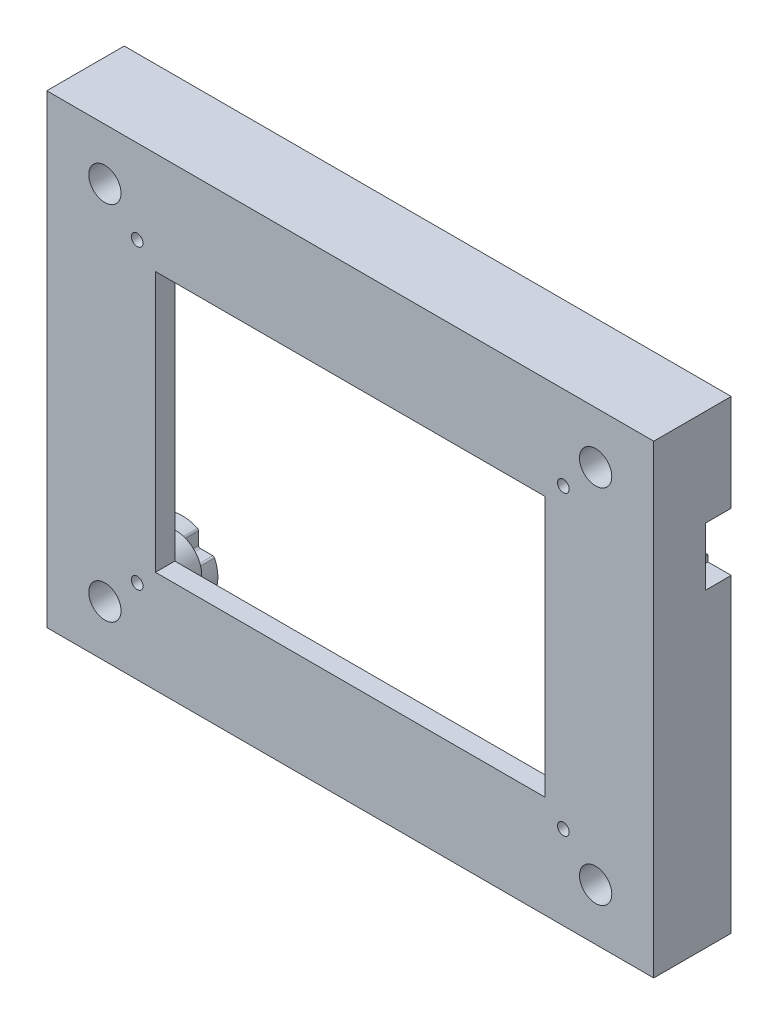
SolidWorks part; units mm, degrees
ref_plane "Front Plane" through (0, 0, 0) normal (0, 0, 1) x (1, 0, 0)
ref_plane "Top Plane" through (0, 0, 0) normal (0, 1, 0) x (1, 0, 0)
ref_plane "Right Plane" through (0, 0, 0) normal (1, 0, 0) x (0, 0, -1)
sketch "草图1" plane through (0, 0, 0) normal (0, 0, 1) x (1, 0, 0)
  line L0 (-34.2251, 32) -> (34.2251, 32)
  line L1 (-47, 36) -> (47, 36)
  line L2 (-47, 36) -> (-47, -36)
  line L3 (-47, -36) -> (47, -36)
  line L4 (47, 36) -> (47, -36)
  line L5 (-47, 36) -> (47, -36) construction
  line L6 (-47, -36) -> (47, 36) construction
  line L8 (-41.7778, 32) -> (-41.7778, 31.9973)
  line L10 (41.7778, 32) -> (41.7778, 31.9973)
  line L11 (-41.7778, 32) -> (41.7778, -32) construction
  line L12 (-41.7778, -32) -> (41.7778, 32) construction
  line L13 (-41.7778, 24.0027) -> (-41.7778, -24.0027)
  line L14 (-41.7778, -31.9973) -> (-41.7778, -32)
  line L15 (-34.2251, -32) -> (34.2251, -32)
  line L16 (41.7749, 32) -> (41.7778, 32)
  line L17 (41.7778, 24.0027) -> (41.7778, -24.0027)
  line L18 (41.7778, -31.9973) -> (41.7778, -32)
  line L19 (41.7749, -32) -> (41.7778, -32)
  circle A0 centre (-38, 28) radius 1.65
  circle A1 centre (-38, -28) radius 1.65
  circle A2 centre (38, 28) radius 1.65
  circle A3 centre (38, -28) radius 1.65
  arc A4 (-41.7778, 24.0027) -> (-34.2251, 32) centre (-38, 28) ccw
  arc A5 (-41.7778, -31.9973) -> (-41.7749, -32) centre (-38, -28) ccw
  arc A6 (34.2251, 32) -> (41.7778, 24.0027) centre (38, 28) ccw
  arc A7 (41.7778, -24.0027) -> (34.2251, -32) centre (38, -28) ccw
  arc A8 (-41.7749, 32) -> (-41.7778, 31.9973) centre (-38, 28) ccw
  arc A9 (-34.2251, -32) -> (-41.7778, -24.0027) centre (-38, -28) ccw
  arc A10 (41.7778, 31.9973) -> (41.7749, 32) centre (38, 28) ccw
  arc A11 (41.7749, -32) -> (41.7778, -31.9973) centre (38, -28) ccw
  point P0 (0, 0)
  point P19 (0, 0)
  point P40 (0, 0)
  dimension "D1" = 3.3
  dimension "D2" = 11
extrude "凸台-拉伸1" add sketch "草图1" along normal blind 12
sketch "草图2" plane through (0, 0, 12) normal (0, 0, 1) x (1, 0, 0)
  circle A0 centre (-38, -28) radius 2.5
  circle A1 centre (-38, 28) radius 2.5
  circle A2 centre (38, 28) radius 2.5
  circle A3 centre (38, -28) radius 2.5
  dimension "D1" = 5
extrude "切除-拉伸1" cut sketch "草图2" against normal blind 7.5
sketch "草图3" plane through (0, 0, 12) normal (0, 0, 1) x (1, 0, 0)
  line L1 (33, -23) -> (-33, -23) construction
  line L2 (33, -23) -> (33, 23) construction
  line L3 (33, 23) -> (-33, 23) construction
  line L4 (-33, -23) -> (-33, 23) construction
  line L5 (33, -23) -> (-33, 23) construction
  line L6 (33, 23) -> (-33, -23) construction
  circle A0 centre (33, -23) radius 4
  circle A1 centre (-33, -23) radius 4
  circle A2 centre (-33, 23) radius 4
  circle A3 centre (33, 23) radius 4
  point P0 (0, 0)
  dimension "D3" = 8
  dimension "D1" = 46
  dimension "D2" = 66
extrude "凸台-拉伸2" add sketch "草图3" against normal blind 6
sketch "草图4" plane through (0, 0, 0) normal (0, 0, -1) x (-1, 0, 0)
  line L1 (-35.5, 25.5) -> (35.5, 25.5)
  line L2 (-35.5, 25.5) -> (-35.5, -25.5)
  line L3 (-35.5, -25.5) -> (35.5, -25.5)
  line L4 (35.5, 25.5) -> (35.5, -25.5)
  line L5 (-35.5, 25.5) -> (35.5, -25.5) construction
  line L6 (-35.5, -25.5) -> (35.5, 25.5) construction
  point P0 (0, 0)
  dimension "D1" = 51
  dimension "D2" = 71
extrude "切除-拉伸2" cut sketch "草图4" against normal up to surface (6 mm away)
fillet "圆角1" radius 0.3 12 edges at (33.101, -25.5, 3) (35.5, -25.5, 3) (35.5, -23.101, 3) (35.5, 23.101, 3) (35.5, 25.5, 3) (33.101, 25.5, 3) (-33.101, 25.5, 3) (-35.5, 23.101, 3) (-35.5, 25.5, 3) (-35.5, -25.5, 3) (-33.101, -25.5, 3) (-35.5, -23.101, 3)
sketch "草图5" plane through (0, 0, 12) normal (0, 0, 1) x (1, 0, 0)
  line L1 (30.1716, -20.1716) -> (-30.1716, -20.1716)
  line L2 (30.1716, -20.1716) -> (30.1716, 20.1716)
  line L3 (30.1716, 20.1716) -> (-30.1716, 20.1716)
  line L4 (-30.1716, -20.1716) -> (-30.1716, 20.1716)
  line L5 (30.1716, -20.1716) -> (-30.1716, 20.1716) construction
  line L6 (30.1716, 20.1716) -> (-30.1716, -20.1716) construction
  line L7 (41.7778, -32) -> (-41.7778, -32)
  line L8 (41.7778, -32) -> (41.7778, 32)
  line L9 (41.7778, 32) -> (-41.7778, 32)
  line L10 (-41.7778, -32) -> (-41.7778, 32)
  line L11 (41.7778, -32) -> (-41.7778, 32) construction
  line L12 (41.7778, 32) -> (-41.7778, -32) construction
  arc A0 (-36.9795, 22.5955) -> (-32.5955, 26.9795) centre (-33, 23) ccw construction
  circle A1 centre (-38, 28) radius 2.5 construction
  circle A2 centre (-38, -28) radius 2.5 construction
  circle A3 centre (38, 28) radius 2.5 construction
  circle A4 centre (38, -28) radius 2.5 construction
  circle A5 centre (-38, 28) radius 2.5
  circle A6 centre (-38, -28) radius 2.5
  circle A7 centre (38, 28) radius 2.5
  circle A8 centre (38, -28) radius 2.5
  point P0 (0, 0)
  point P9 (0, 0)
extrude "凸台-拉伸3" add sketch "草图5" against normal blind 3
sketch "草图6" plane through (0, 0, 6) normal (0, 0, -1) x (-1, 0, 0)
  circle A0 centre (33, 23) radius 0.9
  circle A1 centre (-33, 23) radius 0.9
  circle A2 centre (-33, -23) radius 0.9
  circle A3 centre (33, -23) radius 0.9
  dimension "D1" = 1.8
extrude "切除-拉伸3" cut sketch "草图6" against normal up to next
sketch "草图7" plane through (47, 0, 0) normal (1, 0, 0) x (0, 0, -1)
  line L0 (0, 36) -> (0, -36) construction
  line L1 (0, 21) -> (-4, 21)
  line L2 (0, 21) -> (0, 12)
  line L3 (0, 12) -> (-4, 12)
  line L4 (-4, 21) -> (-4, 12)
  line L5 (-12, 36) -> (0, 36) construction
  point P6 (-2, 21)
  dimension "D1" = 9
  dimension "D2" = 4
  dimension "D3" = 15
extrude "切除-拉伸4" cut sketch "草图7" against normal blind 3.6
sketch "草图8" plane through (43.4, 0, 0) normal (1, 0, 0) x (0, 0, -1)
  line L0 (0, 12) -> (0, 21) construction
  line L1 (0, 20) -> (-3, 20)
  line L2 (0, 20) -> (0, 13)
  line L3 (0, 13) -> (-3, 13)
  line L4 (-3, 20) -> (-3, 13)
  line L5 (0, 21) -> (-4, 21) construction
  line L6 (-4, 12) -> (0, 12) construction
  line L7 (-4, 21) -> (-4, 12) construction
  dimension "D1" = 1
  dimension "D2" = 1
  dimension "D3" = 1
extrude "切除-拉伸5" cut sketch "草图8" against normal blind 3.6
